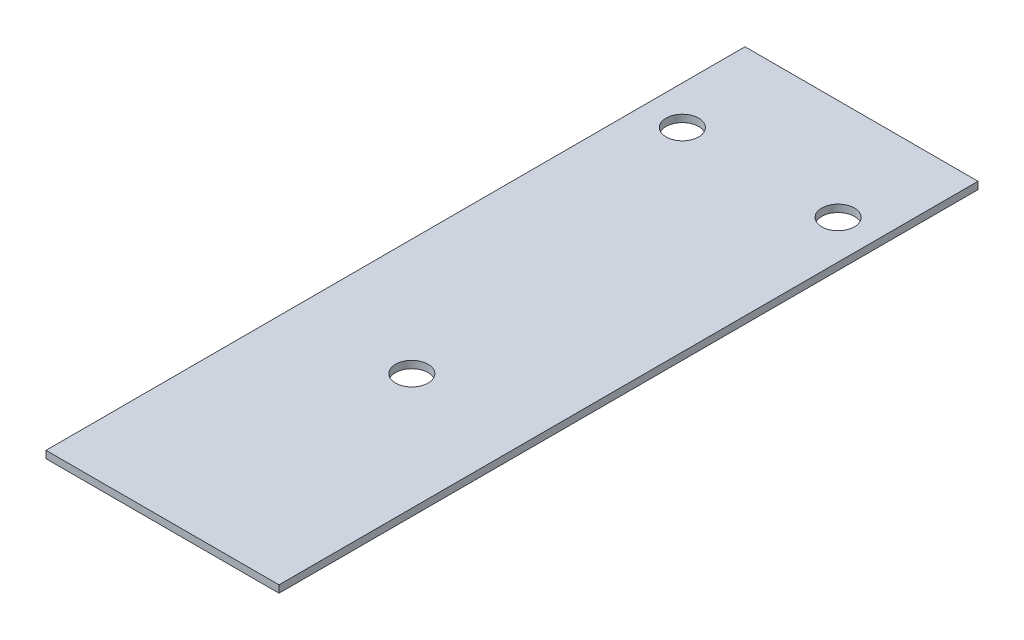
SolidWorks part; units mm, degrees
ref_plane "Front Plane" through (0, 0, 0) normal (0, 0, 1) x (1, 0, 0)
ref_plane "Top Plane" through (0, 0, 0) normal (0, 1, 0) x (1, 0, 0)
ref_plane "Right Plane" through (0, 0, 0) normal (1, 0, 0) x (0, 0, -1)
sketch "Sketch1" plane through (0, 0, 0) normal (0, 1, 0) x (1, 0, 0)
  line L1 (-76.2, -228.6) -> (76.2, -228.6)
  line L2 (-76.2, -228.6) -> (-76.2, 228.6)
  line L3 (-76.2, 228.6) -> (76.2, 228.6)
  line L4 (76.2, -228.6) -> (76.2, 228.6)
  line L5 (-76.2, -228.6) -> (76.2, 228.6) construction
  line L6 (-76.2, 228.6) -> (76.2, -228.6) construction
  point P0 (0, 0)
  dimension "D1" = 152.4
  dimension "D2" = 457.2
extrude "Boss-Extrude1" add sketch "Sketch1" along normal blind 4.7625
sketch "Sketch3" plane through (0, 4.7625, 0) normal (0, 1, 0) x (1, 0, 0)
  line L0 (-50.927, 162.3695) -> (50.927, 162.3695) construction
  line L1 (-50.927, 173.0375) -> (50.927, 173.0375) construction
  line L2 (76.2, 228.6) -> (-76.2, 228.6) construction
  line L4 (-76.2, -228.6) -> (76.2, -228.6) construction
  circle A0 centre (-50.927, 162.3695) radius 10.668
  circle A1 centre (50.927, 162.3695) radius 10.668
  circle A2 centre (0, -65.532) radius 10.668
  point P4 (0, 162.3695)
  point P12 (0, -76.2)
  dimension "D3" = 21.336
  dimension "D1" = 101.854
  dimension "D2" = 55.5625
  dimension "D4" = 152.4
extrude "Cut-Extrude1" cut sketch "Sketch3" against normal through all
